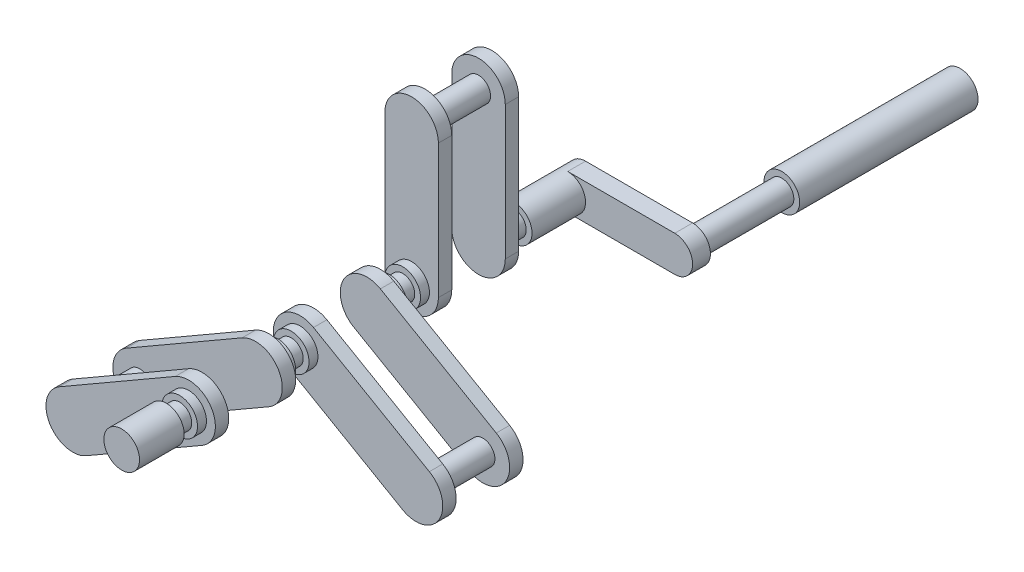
SolidWorks part; units mm, degrees
ref_plane "前视基准面" through (0, 0, 0) normal (0, 0, 1) x (1, 0, 0)
ref_plane "上视基准面" through (0, 0, 0) normal (0, 1, 0) x (1, 0, 0)
ref_plane "右视基准面" through (0, 0, 0) normal (1, 0, 0) x (0, 0, -1)
other "Configuration Table"
sketch "草图1" plane through (0, 0, 0) normal (0, 0, 1) x (1, 0, 0)
  circle A0 centre (0, 0) radius 1.35
  dimension "D1" = 2.7
extrude "凸台-拉伸1" add sketch "草图1" along normal blind 2.5 contours A0
sketch "草图2" plane through (0, 0, 2.5) normal (0, 0, 1) x (1, 0, 0)
  line L0 (0, 0) -> (0, 15) construction
  line L1 (3, 15) -> (3, 0)
  line L2 (-3, 15) -> (-3, 0)
  arc A0 (-3, 0) -> (3, 0) centre (0, 0) ccw
  arc A1 (3, 15) -> (-3, 15) centre (0, 15) ccw
  dimension "D1" = 6
  dimension "D3" = 6
  dimension "D2" = 15
extrude "凸台-拉伸2" add sketch "草图2" along normal blind 1.5
sketch "草图3" plane through (0, 0, 4) normal (0, 0, 1) x (1, 0, 0)
  line L0 (0, 0) -> (0, 15) construction
  circle A0 centre (0, 15) radius 1.35
  dimension "D2" = 2.7
  dimension "D1" = 15
extrude "凸台-拉伸3" add sketch "草图3" along normal blind 6
sketch "草图4" plane through (0, 0, 10) normal (0, 0, 1) x (1, 0, 0)
  line L0 (0, 0) -> (0, 15) construction
  line L1 (3, 15) -> (3, 0)
  line L2 (-3, 15) -> (-3, 0)
  arc A0 (3, 15) -> (-3, 15) centre (0, 15) ccw
  arc A1 (-3, 0) -> (3, 0) centre (0, 0) ccw
  dimension "D2" = 6
  dimension "D3" = 6
  dimension "D1" = 15
extrude "凸台-拉伸4" add sketch "草图4" along normal blind 1.5
sketch "草图5" plane through (0, 0, 11.5) normal (0, 0, 1) x (1, 0, 0)
  circle A0 centre (0, 0) radius 1.35
  dimension "D1" = 2.7
extrude "凸台-拉伸5" add sketch "草图5" along normal blind 3.5
sketch "草图6" plane through (0, 0, 15) normal (0, 0, 1) x (1, 0, 0)
  line L0 (0, 0) -> (0, 15) construction
  line L1 (0, 0) -> (12.9904, -7.5) construction
  line L2 (14.4904, -4.9019) -> (1.5, 2.5981)
  line L3 (11.4904, -10.0981) -> (-1.5, -2.5981)
  arc A0 (1.5, 2.5981) -> (-1.5, -2.5981) centre (0, 0) ccw
  arc A1 (11.4904, -10.0981) -> (14.4904, -4.9019) centre (12.9904, -7.5) ccw
  dimension "D4" = 6
  dimension "D5" = 6
  dimension "D1" = 15
  dimension "D2" = 15
  dimension "D3" = 120
extrude "凸台-拉伸6" add sketch "草图6" along normal blind 1.5
sketch "草图7" plane through (0, 0, 16.5) normal (0, 0, 1) x (1, 0, 0)
  line L0 (0, 0) -> (0, 14.8374) construction
  line L1 (0, 0) -> (12.9904, -7.5) construction
  circle A0 centre (12.9904, -7.5) radius 1.35
  dimension "D3" = 2.7
  dimension "D1" = 120
  dimension "D2" = 15
extrude "凸台-拉伸7" add sketch "草图7" along normal blind 6
sketch "草图8" plane through (0, 0, 22.5) normal (0, 0, 1) x (1, 0, 0)
  line L0 (0, 0) -> (0, 15) construction
  line L1 (0, 0) -> (12.9904, -7.5) construction
  line L2 (1.5, 2.5981) -> (14.4904, -4.9019)
  line L3 (-1.5, -2.5981) -> (11.4904, -10.0981)
  arc A0 (1.5, 2.5981) -> (-1.5, -2.5981) centre (0, 0) ccw
  arc A1 (11.4904, -10.0981) -> (14.4904, -4.9019) centre (12.9904, -7.5) ccw
  dimension "D3" = 6
  dimension "D4" = 6
  dimension "D1" = 15
  dimension "D2" = 120
extrude "凸台-拉伸8" add sketch "草图8" along normal blind 1.5
sketch "草图9" plane through (0, 0, 11.5) normal (0, 0, 1) x (1, 0, 0)
  circle A0 centre (0, 0) radius 2
  dimension "D1" = 4
extrude "凸台-拉伸9" add sketch "草图9" along normal blind 1
sketch "草图10" plane through (0, 0, 15) normal (0, 0, -1) x (-1, 0, 0)
  circle A0 centre (0, 0) radius 2
  dimension "D1" = 4
extrude "凸台-拉伸10" add sketch "草图10" along normal blind 1
sketch "草图11" plane through (0, 0, 24) normal (0, 0, 1) x (1, 0, 0)
  circle A0 centre (0, 0) radius 1.35
  dimension "D1" = 2.7
extrude "凸台-拉伸11" add sketch "草图11" along normal blind 3.5
sketch "草图12" plane through (0, 0, 27.5) normal (0, 0, 1) x (1, 0, 0)
  line L0 (0, 0) -> (0, 15) construction
  line L1 (0, 0) -> (-12.9904, -7.5) construction
  line L2 (-1.5, 2.5981) -> (-14.4904, -4.9019)
  line L3 (1.5, -2.5981) -> (-11.4904, -10.0981)
  arc A0 (1.5, -2.5981) -> (-1.5, 2.5981) centre (0, 0) ccw
  arc A1 (-14.4904, -4.9019) -> (-11.4904, -10.0981) centre (-12.9904, -7.5) ccw
  dimension "D4" = 6
  dimension "D5" = 6
  dimension "D1" = 15
  dimension "D2" = 15
  dimension "D3" = 120
extrude "凸台-拉伸12" add sketch "草图12" along normal blind 1.5
sketch "草图15" plane through (0, 0, 29) normal (0, 0, 1) x (1, 0, 0)
  line L0 (0, 0) -> (0, 12.5405) construction
  line L1 (0, 0) -> (-12.9904, -7.5) construction
  circle A0 centre (-12.9904, -7.5) radius 1.35
  dimension "D3" = 2.7
  dimension "D1" = 15
  dimension "D2" = 120
extrude "凸台-拉伸15" add sketch "草图15" along normal blind 6
sketch "草图16" plane through (0, 0, 35) normal (0, 0, 1) x (1, 0, 0)
  line L0 (0, 0) -> (-12.9904, -7.5) construction
  line L1 (-1.5, 2.5981) -> (-14.4904, -4.9019)
  line L2 (1.5, -2.5981) -> (-11.4904, -10.0981)
  arc A0 (1.5, -2.5981) -> (-1.5, 2.5981) centre (0, 0) ccw
  arc A1 (-14.4904, -4.9019) -> (-11.4904, -10.0981) centre (-12.9904, -7.5) ccw
  dimension "D1" = 6
  dimension "D2" = 6
extrude "凸台-拉伸16" add sketch "草图16" along normal blind 1.5
sketch "草图17" plane through (0, 0, 24) normal (0, 0, 1) x (1, 0, 0)
  circle A0 centre (0, 0) radius 2
  dimension "D1" = 4
extrude "凸台-拉伸17" add sketch "草图17" along normal blind 1
sketch "草图18" plane through (0, 0, 27.5) normal (0, 0, -1) x (-1, 0, 0)
  circle A0 centre (0, 0) radius 2
  dimension "D1" = 4
extrude "凸台-拉伸18" add sketch "草图18" along normal blind 1
sketch "草图19" plane through (0, 0, 36.5) normal (0, 0, 1) x (1, 0, 0)
  circle A0 centre (0, 0) radius 1.35
  dimension "D1" = 2.7
extrude "凸台-拉伸19" add sketch "草图19" along normal blind 2.5
sketch "草图20" plane through (0, 0, 2.5) normal (0, 0, -1) x (-1, 0, 0)
  circle A0 centre (0, 0) radius 2
  dimension "D1" = 4
extrude "凸台-拉伸20" add sketch "草图20" along normal blind 1
sketch "草图21" plane through (0, 0, 0) normal (0, 0, -1) x (-1, 0, 0)
  circle A0 centre (0, 0) radius 2
  dimension "D1" = 4
extrude "凸台-拉伸21" add sketch "草图21" along normal blind 8
sketch "草图22" plane through (0, 0, -8) normal (0, 0, -1) x (-1, 0, 0)
  line L0 (0, 0) -> (-12, 0) construction
  line L1 (0, 0) -> (0, 2)
  line L2 (0, 2) -> (-12, 2)
  line L4 (-12, -2) -> (0, -2)
  line L5 (0, -2) -> (0, 2)
  circle A0 centre (0, 0) radius 2 construction
  arc A1 (-12, 2) -> (-12, -2) centre (-12, 0) ccw
  dimension "D2" = 2
  dimension "D1" = 12
extrude "凸台-拉伸22" add sketch "草图22" against normal blind 2
sketch "草图23" plane through (0, 0, -8) normal (0, 0, -1) x (-1, 0, 0)
  line L0 (0, 0) -> (-12, 0) construction
  circle A0 centre (-12, 0) radius 1.35
  dimension "D2" = 2.7
  dimension "D1" = 12
extrude "凸台-拉伸23" add sketch "草图23" along normal blind 10
sketch "草图24" plane through (0, 0, -18) normal (0, 0, -1) x (-1, 0, 0)
  circle A0 centre (-12, 0) radius 2
  dimension "D1" = 4
extrude "凸台-拉伸24" add sketch "草图24" along normal blind 20
sketch "草图25" plane through (0, 0, 36.5) normal (0, 0, 1) x (1, 0, 0)
  circle A0 centre (0, 0) radius 2
  dimension "D1" = 4
extrude "凸台-拉伸25" add sketch "草图25" along normal blind 1
sketch "草图26" plane through (0, 0, 39) normal (0, 0, 1) x (1, 0, 0)
  circle A0 centre (0, 0) radius 2
  dimension "D1" = 4
extrude "凸台-拉伸26" add sketch "草图26" along normal blind 5
